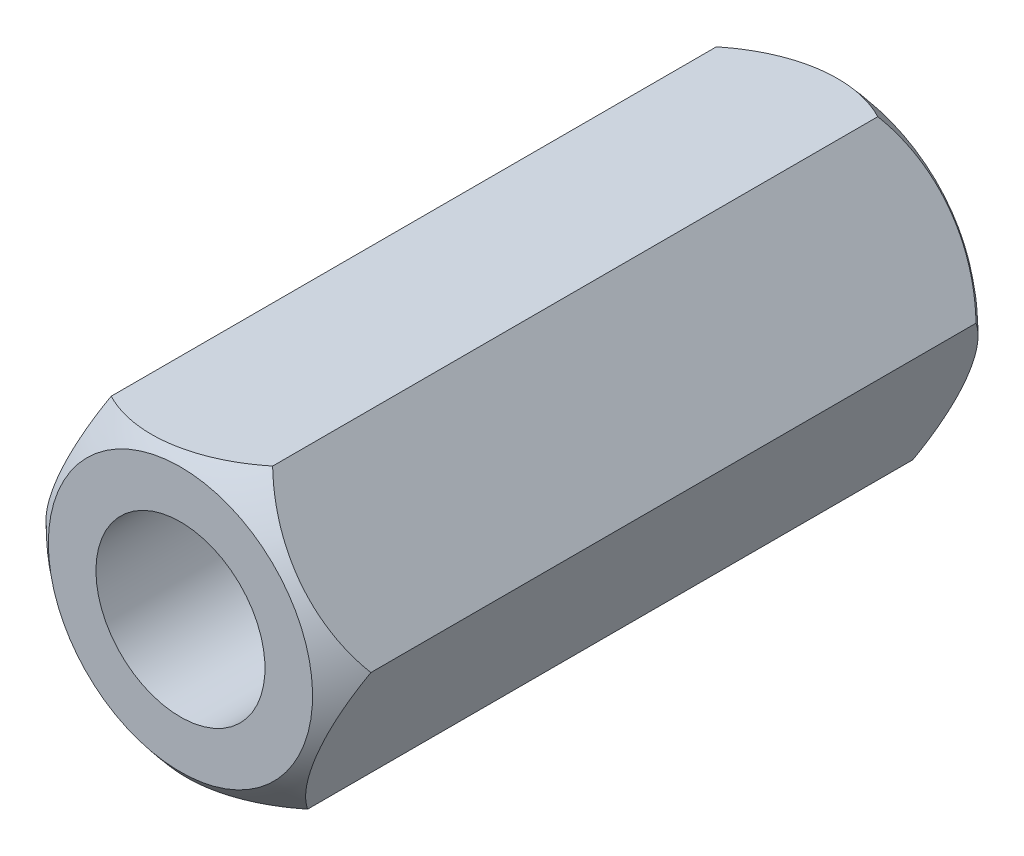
SolidWorks part; units mm, degrees
ref_plane "Plan de face" through (0, 0, 0) normal (0, 0, 1) x (1, 0, 0)
ref_plane "Plan de dessus" through (0, 0, 0) normal (0, 1, 0) x (1, 0, 0)
ref_plane "Plan de droite" through (0, 0, 0) normal (1, 0, 0) x (0, 0, -1)
sketch "Esquisse1" plane through (0, 0, 0) normal (0, 0, 1) x (1, 0, 0)
  line L1 (3.8131, 9.044) -> (-5.9257, 7.8243)
  line L2 (-5.9257, 7.8243) -> (-9.7389, -1.2197)
  line L3 (-9.7389, -1.2197) -> (-3.8131, -9.044)
  line L4 (-3.8131, -9.044) -> (5.9257, -7.8243)
  line L5 (5.9257, -7.8243) -> (9.7389, 1.2197)
  line L6 (9.7389, 1.2197) -> (3.8131, 9.044)
  circle A0 centre (0, 0) radius 8.5 construction
  dimension "D1" = 17
extrude "Extrusion1" add sketch "Esquisse1" along normal blind 40
hole_wizard "Trou taraudé M121" positions "Esquisse4" profile "Esquisse3" tap size "M12" standard "ISO"
sketch "Esquisse4" plane through (0, 0, 0) normal (0, 0, -1) x (-1, 0, 0)
  point P0 (0, 0)
sketch "Esquisse3" plane through (0, 0, 0) normal (1, 0, 0) x (0, 1, 0)
  line L0 (0, 0) -> (0, 40)
  line L1 (0, 40) -> (5.1, 40)
  line L2 (5.1, 40) -> (5.1, 0)
  line L5 (5.1, 0) -> (0, 0)
  line L11 (0, -6.35) -> (0, 107.95) construction
  dimension "Diamètre du trou pour taraudage jusqu'au prochain" = 10.2
  dimension "Profondeur du trou pour taraudage jusqu'au prochain" = 40
sketch "Esquisse5" plane through (0, 0, 0) normal (0, 1, 0) x (1, 0, 0)
  line L0 (0, 7.3893) -> (0, 2.7312)
  line L1 (0, 7.3893) -> (12.9938, 7.3893)
  line L2 (12.9938, 7.3893) -> (12.9938, -10.2626)
  line L3 (0, -10.2626) -> (0, 11.3226) construction
  line L4 (0, -20) -> (19.0795, -20) construction
  line L5 (12.9938, -47.3893) -> (12.9938, -29.7374)
  line L6 (0, -47.3893) -> (12.9938, -47.3893)
  line L7 (0, -47.3893) -> (0, -42.7312)
  arc A0 (12.9938, -10.2626) -> (0, 2.7312) centre (0, -10.2626) ccw
  arc A1 (12.9938, -29.7374) -> (0, -42.7312) centre (0, -29.7374) cw
revolve "Enlèvement de matière-Révolution1" cut sketch "Esquisse5" angle 360 about L3
